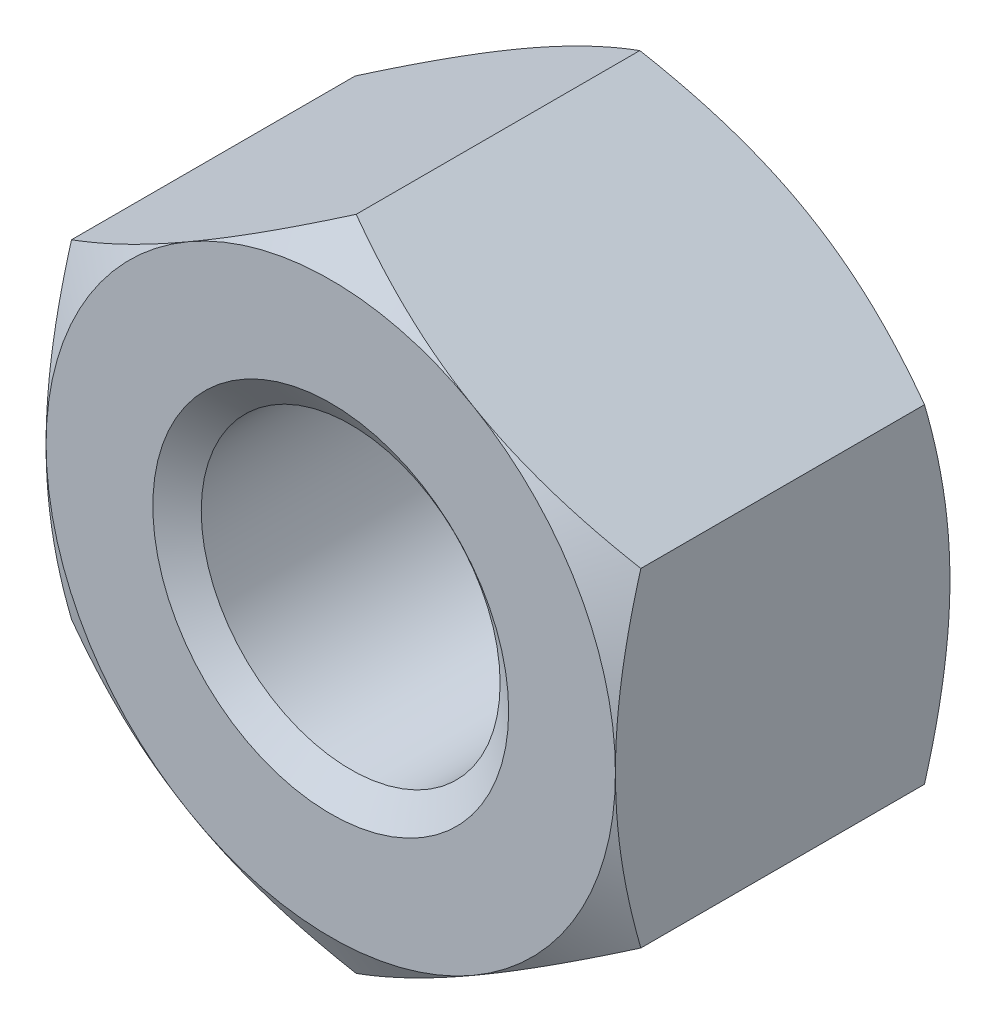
SolidWorks part; units mm, degrees
ref_plane "Plane1" through (0, 0, 0) normal (0, 0, 1) x (1, 0, 0)
ref_plane "Plane2" through (0, 0, 0) normal (0, 1, 0) x (1, 0, 0)
ref_plane "Plane3" through (0, 0, 0) normal (1, 0, 0) x (0, 0, -1)
revolve "EndChamfer" cut sketch "Sketch5"
sketch "Sketch5"
  line L0 (4.6746, 2.5) -> (4.3665, 2.06)
  line L1 (4.7254, 2.5) -> (4.6746, 2.5)
  line L2 (4.7254, 2.5) -> (4.7254, 2.06)
  line L3 (4.7254, 2.06) -> (4.3665, 2.06)
  line L6 (-0.0508, 2.5) -> (0, 2.5)
  line L7 (0, 2.5) -> (0.3081, 2.06)
  line L9 (0.3081, 2.06) -> (-0.0508, 2.06)
  line L10 (-0.0508, 2.06) -> (-0.0508, 2.5)
  line L11 (25.0375, 0) -> (38.388, 0) construction
  line L12 (4.7, 0) -> (0, 0) construction
extrude "BaseNut" add sketch "BaseNutSke" against normal blind 4.7
sketch "BaseNutSke" plane through (0, 0, 0) normal (0, 0, 1) x (1, 0, 0)
  line L6 (4, 2.3094) -> (4, -2.3094)
  line L7 (-4, 2.3094) -> (-4, -2.3094)
  line L8 (4, 2.3094) -> (0, 4.6188)
  line L9 (0, 4.6188) -> (-4, 2.3094)
  line L10 (-4, -2.3094) -> (0, -4.6188)
  line L11 (0, -4.6188) -> (4, -2.3094)
  circle A0 centre (0, 0) radius 2.1
  dimension "D4" = 4
  dimension "Tap_drill" = 4.2
  dimension "D1" = 120
  dimension "D2" = 4
  dimension "D3" = 4
  dimension "Width_flats" = 8
pattern_linear "ThdSchPat"
revolve "ThreadSchematic" cut sketch "ThdSchSke" angle 360 about L11
sketch "ThdSchSke" plane through (0, 0, 0) normal (0, 1, 0) x (1, 0, 0)
  line L0 (-2.5, 0.0254) -> (-2.1, 0.3055)
  line L1 (-2.1, 0.3055) -> (-1.05, 0.3055)
  line L2 (-1.05, 0.3055) -> (-1.05, -0.2547)
  line L3 (-1.05, -0.2547) -> (-2.1, -0.2547)
  line L4 (-2.1, -0.2547) -> (-2.5, 0.0254)
  line L5 (-3.175, 0.8) -> (3.175, 0.8) construction
  line L6 (0, 0.8) -> (0, -2.9874) construction
  line L7 (0, 4.3945) -> (0, 0.2801) construction
  dimension "D1" = 35
  dimension "VeeAngle" = 70
  dimension "SideAngle" = 55
  dimension "D2" = 0.0508
  dimension "OverCut" = 2.1
  dimension "Tap_Drill" = 4.2
  dimension "Advance" = 0.7749
  dimension "Thread_major" = 5
  dimension "Num_threads" = 7
  dimension "D4" = 50
  dimension "Offset1" = 4.7254
  dimension "ThreadMajor" = 2.5
  dimension "ChamferDepth" = 0.44
  dimension "Offset2" = 4.7762
sketch "Sketch4" plane through (0, 0, 0) normal (1, 0, 0) x (0, 0, -1)
  line L0 (4.7, 4) -> (4.69, 4)
  line L1 (4.7, 4) -> (4.7, 14.6188)
  line L2 (4.69, 14.6188) -> (4.7, 14.6188)
  line L3 (4.69, 14.6188) -> (4.69, 4)
  line L4 (0, 0) -> (34.925, 0) construction
  line L6 (4.7, 2.3094) -> (4.7, 4.6188) construction
  line L7 (0, 4) -> (-10, 4)
  line L8 (0, 2.3094) -> (0, 4.6188) construction
  line L9 (0.3573, 4.6188) -> (0.3573, 14.6188)
  line L10 (0.3573, 14.6188) -> (-10, 14.6188)
  line L11 (-10, 14.6188) -> (-10, 4)
  line L12 (0, 4) -> (0.3573, 4.6188)
  line L14 (0, 2.3094) -> (0, -2.3094) construction
  line L15 (4.7, 4.6188) -> (0, 4.6188) construction
  dimension "D1" = 4
  dimension "D2" = 30
  dimension "Bearing_ht" = 0.01
  dimension "D3" = 10
  dimension "D4" = 10
revolve "Bearing-Face" cut sketch "Sketch4" angle 360 about L4
sketch "Sketch3" plane through (0, 0, 0) normal (1, 0, 0) x (0, 0, -1)
  line L0 (4.7, 4) -> (4.3427, 4.6188)
  line L1 (4.3427, 4.6188) -> (4.3427, 14.6188)
  line L2 (4.3427, 14.6188) -> (14.7, 14.6188)
  line L3 (14.7, 14.6188) -> (14.7, 4)
  line L4 (14.7, 4) -> (4.7, 4)
  line L5 (4.7, 2.3094) -> (4.7, 4.6188) construction
  line L6 (4.7, 4.6188) -> (0, 4.6188) construction
  line L7 (0, 0) -> (38.6776, 0) construction
  line L8 (4.7, 0) -> (0, 0) construction
  line L9 (2.35, 4.6188) -> (2.35, 44.222) construction
  line L10 (0.3573, 14.6188) -> (-10, 14.6188)
  line L11 (-10, 14.6188) -> (-10, 4)
  line L12 (-10, 4) -> (0, 4)
  line L13 (0, 4) -> (0.3573, 4.6188)
  line L14 (0.3573, 4.6188) -> (0.3573, 14.6188)
  line L16 (4.7, 4.6188) -> (0, 4.6188) construction
  dimension "D1" = 4
  dimension "D2" = 30
  dimension "D3" = 10
  dimension "D4" = 10
revolve "Double-Chamfer" cut sketch "Sketch3" angle 360 about L7
equation "\"D2@BaseNutSke\" = \"Width_flats@BaseNutSke\" / 2"
equation "\"D3@BaseNutSke\" = \"Width_flats@BaseNutSke\" / 2"
equation "\"D1@Sketch3\" = \"Width_flats@BaseNutSke\" /2"
equation "\"D1@Sketch4\" = \"D2@BaseNutSke\""
equation "\"D4@BaseNutSke\" = \"D3@BaseNutSke\""
equation "\"Thread_major@ThdSchSke\" = \"Thread_major@ThreadCosmetic\""
equation "\"Tap_drill@ThdSchSke\" = \"Tap_drill@BaseNutSke\""
equation "\"Overcut@ThdSchSke\" = \"Tap_drill@ThdSchSke\" * 0.5"
equation "\"Num_threads@ThdSchPat\" = int(  ( \"Thickness@BaseNut\" - 0.0508 ) / \"Advance@ThdSchSke\" + 0.999 )  + 1"
equation "\"Advance@ThdSchPat\" = ( \"Thickness@BaseNut\" - 0.0508 ) /  (\"Num_threads@ThdSchPat\" - 1) 'relax it"
equation "' \"Num_threads@ThdSchPat\" = \"Num_threads@ThdSchPat\" - sgn( \"Num_threads@ThdSchPat\" - 1) '---chamfered tips only---"
equation "\"ThreadMajor@Sketch5\" = \"Thread_major@ThreadCosmetic\" * 0.5"
equation "\"ChamferDepth@Sketch5\" = (\"Thread_major@ThreadCosmetic\" - \"Tap_drill@BaseNutSke\") * 0.55"
equation "\"Offset1@Sketch5\" = \"Thickness@BaseNut\" + 0.0254"
equation "\"Offset2@Sketch5\" = \"Offset1@Sketch5\" + 0.0508"
